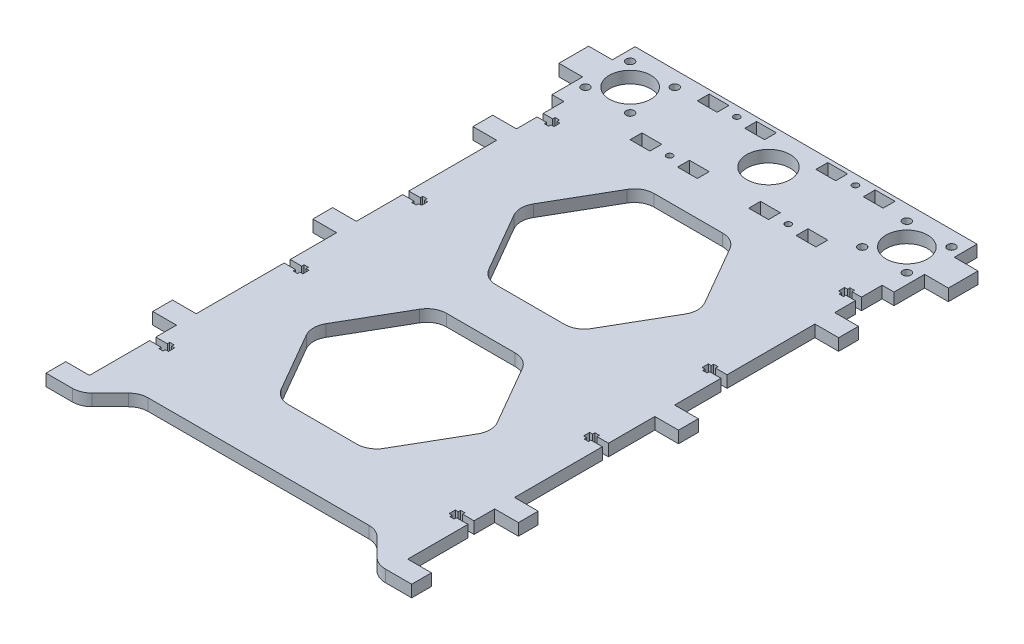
SolidWorks part; units mm, degrees
ref_plane "Спереди" through (0, 0, 0) normal (0, 0, 1) x (1, 0, 0)
ref_plane "Сверху" through (0, 0, 0) normal (0, 1, 0) x (1, 0, 0)
ref_plane "Справа" through (0, 0, 0) normal (1, 0, 0) x (0, 0, -1)
sketch "Эскиз1" plane through (0, 0, 0) normal (0, 1, 0) x (1, 0, 0)
  line L0 (0, 174.0474) -> (0, 0) construction
  line L1 (0, 0) -> (123.4483, 0) construction
  line L2 (13, 150) -> (23, 150)
  line L3 (86.5, 152) -> (86.5, 140.5)
  line L4 (92.5, -140) -> (0, -140)
  line L5 (0, 133) -> (112.9832, 133) construction
  line L6 (86.5, 140.5) -> (98.5, 140.5)
  line L7 (98.5, 140.5) -> (98.5, 125.5)
  line L8 (98.5, 125.5) -> (86.5, 125.5)
  line L9 (86.5, 125.5) -> (86.5, 110)
  line L10 (23, 150) -> (23, 144)
  line L11 (23, 144) -> (13, 144)
  line L12 (13, 144) -> (13, 150)
  line L13 (37, 150) -> (47, 150)
  line L14 (30, 147) -> (30, 154.7506) construction
  line L15 (18, 144) -> (18, 152.7899) construction
  line L16 (47, 144) -> (47, 150)
  line L17 (37, 144) -> (47, 144)
  line L18 (37, 150) -> (37, 144)
  line L19 (13, 147) -> (47, 147) construction
  line L20 (86.5, 110) -> (80.5, 110)
  line L21 (80.5, 110) -> (80.5, 99.55)
  line L22 (92.5, -140) -> (92.5, -130)
  line L23 (92.5, -130) -> (80.5, -130)
  line L24 (80.5, -86) -> (80.5, -96.45)
  line L25 (0, 152) -> (86.5, 152)
  line L28 (80.5, -5) -> (92.5, -5)
  line L29 (92.5, -5) -> (92.5, 5)
  line L30 (92.5, 5) -> (80.5, 5)
  line L31 (80.5, -5) -> (80.5, -28.45)
  line L32 (0, 152) -> (0, 144)
  line L33 (0, 122) -> (0, -140)
  line L34 (80.5, 98) -> (67.761, 98) construction
  line L35 (58.7, 121.7) -> (81.3, 121.7) construction
  line L36 (58.7, 121.7) -> (58.7, 144.3) construction
  line L37 (58.7, 144.3) -> (81.3, 144.3) construction
  line L38 (81.3, 121.7) -> (81.3, 144.3) construction
  line L39 (58.7, 121.7) -> (81.3, 144.3) construction
  line L40 (58.7, 144.3) -> (81.3, 121.7) construction
  line L41 (80.5, 99.55) -> (75.7, 99.55)
  line L42 (75.7, 99.55) -> (75.7, 100.75)
  line L43 (75.7, 100.75) -> (73.5, 100.75)
  line L44 (73.5, 100.75) -> (73.5, 99.55)
  line L45 (73.5, 99.55) -> (72, 99.55)
  line L46 (72, 99.55) -> (72, 96.45)
  line L47 (73.5, 96.45) -> (72, 96.45)
  line L48 (73.5, 95.25) -> (73.5, 96.45)
  line L49 (75.7, 95.25) -> (73.5, 95.25)
  line L50 (75.7, 96.45) -> (75.7, 95.25)
  line L51 (80.5, 96.45) -> (75.7, 96.45)
  line L52 (80.5, 96.45) -> (80.5, 86)
  line L53 (87.2498, 30) -> (69.0562, 30) construction
  line L54 (80.5, 31.55) -> (74.7, 31.55)
  line L55 (74.7, 31.55) -> (74.7, 32.75)
  line L56 (74.7, 32.75) -> (72.5, 32.75)
  line L57 (72.5, 32.75) -> (72.5, 31.55)
  line L58 (72.5, 31.55) -> (71, 31.55)
  line L59 (71, 31.55) -> (71, 28.45)
  line L60 (72.5, 28.45) -> (71, 28.45)
  line L61 (72.5, 27.25) -> (72.5, 28.45)
  line L62 (74.7, 27.25) -> (72.5, 27.25)
  line L63 (74.7, 28.45) -> (74.7, 27.25)
  line L64 (80.5, 28.45) -> (74.7, 28.45)
  line L65 (80.5, 28.45) -> (80.5, 5)
  line L67 (80.5, -96.45) -> (74.7, -96.45)
  line L68 (74.7, -96.45) -> (74.7, -95.25)
  line L69 (74.7, -95.25) -> (72.5, -95.25)
  line L70 (72.5, -95.25) -> (72.5, -96.45)
  line L71 (72.5, -96.45) -> (71, -96.45)
  line L72 (71, -99.55) -> (71, -96.45)
  line L73 (72.5, -99.55) -> (71, -99.55)
  line L74 (72.5, -100.75) -> (72.5, -99.55)
  line L75 (74.7, -100.75) -> (72.5, -100.75)
  line L76 (74.7, -99.55) -> (74.7, -100.75)
  line L77 (80.5, -99.55) -> (74.7, -99.55)
  line L78 (87.2498, -30) -> (69.0562, -30) construction
  line L79 (80.5, -28.45) -> (74.7, -28.45)
  line L80 (74.7, -28.45) -> (74.7, -27.25)
  line L81 (74.7, -27.25) -> (72.5, -27.25)
  line L82 (72.5, -27.25) -> (72.5, -28.45)
  line L83 (72.5, -28.45) -> (71, -28.45)
  line L84 (71, -31.55) -> (71, -28.45)
  line L85 (72.5, -31.55) -> (71, -31.55)
  line L86 (72.5, -32.75) -> (72.5, -31.55)
  line L87 (74.7, -32.75) -> (72.5, -32.75)
  line L88 (74.7, -31.55) -> (74.7, -32.75)
  line L89 (80.5, -31.55) -> (74.7, -31.55)
  line L90 (80.5, -99.55) -> (80.5, -130)
  line L91 (80.5, -31.55) -> (80.5, -76)
  line L92 (13, 110) -> (23, 110)
  line L93 (47, 110) -> (37, 110)
  line L94 (47, 110) -> (47, 116)
  line L95 (47, 116) -> (37, 116)
  line L96 (37, 110) -> (37, 116)
  line L97 (23, 110) -> (23, 116)
  line L98 (13, 116) -> (23, 116)
  line L99 (13, 110) -> (13, 116)
  line L100 (23, 113) -> (37, 113) construction
  line L101 (80.5, 86) -> (92.5, 86)
  line L102 (92.5, 86) -> (92.5, 76)
  line L103 (92.5, 76) -> (80.5, 76)
  line L104 (80.5, 76) -> (80.5, 31.55)
  line L105 (92.5, -76) -> (80.5, -76)
  line L106 (92.5, -86) -> (92.5, -76)
  line L107 (80.5, -86) -> (92.5, -86)
  arc A0 (0, 122) -> (0, 144) centre (0, 133) ccw
  circle A1 centre (70, 133) radius 10.5
  circle A2 centre (30, 147) radius 1.55
  circle A3 centre (58.7, 144.3) radius 2.05
  circle A4 centre (81.3, 144.3) radius 2.05
  circle A5 centre (58.7, 121.7) radius 2.05
  circle A6 centre (81.3, 121.7) radius 2.05
  circle A7 centre (30, 113) radius 1.55
  point P43 (92.5, 0)
  dimension "D2" = 21
  dimension "D3" = 22
  dimension "D4" = 10
  dimension "D9" = 3.1
  dimension "D10" = 60
  dimension "D11" = 6
  dimension "D12" = 12
  dimension "D14" = 11
  dimension "D15" = 19
  dimension "D16" = 240
  dimension "D19" = 4.1
  dimension "D1" = 140
  dimension "D5" = 15
  dimension "D6" = 12
  dimension "D7" = 6
  dimension "D8" = 173
  dimension "D13" = 10
  dimension "D17" = 23
  dimension "D18" = 22.6
  dimension "D20" = 3.1
  dimension "D21" = 2.2
  dimension "D22" = 5.5
  dimension "D23" = 1.5
  dimension "D24" = 8.5
  dimension "D25" = 12
  dimension "D26" = 7.5
  dimension "D27" = 12
  dimension "D28" = 12
  dimension "D29" = 133
  dimension "D30" = 30
  dimension "D31" = 10
  dimension "D32" = 9.5
extrude "Бобышка-Вытянуть2" add sketch "Эскиз1" along normal blind 6
mirror "Зеркальное отражение1" about plane through (0, 6, -122) normal (1, 0, 0)
sketch "Эскиз2" plane through (0, 6, 0) normal (0, 1, 0) x (1, 0, 0)
  line L0 (0, 0) -> (0, 164.4816) construction
  line L1 (0, 0) -> (148.1195, 0) construction
  line L3 (23.094, 12.5) -> (46.188, 52.5)
  line L4 (46.188, 52.5) -> (23.094, 92.5)
  line L5 (23.094, 92.5) -> (-23.094, 92.5)
  line L6 (-23.094, 92.5) -> (-46.188, 52.5)
  line L7 (-46.188, 52.5) -> (-23.094, 12.5)
  line L8 (-23.094, 12.5) -> (23.094, 12.5)
  line L9 (23.094, -12.5) -> (46.188, -52.5)
  line L10 (-23.094, -12.5) -> (23.094, -12.5)
  line L11 (-46.188, -52.5) -> (-23.094, -12.5)
  line L12 (-23.094, -92.5) -> (-46.188, -52.5)
  line L13 (23.094, -92.5) -> (-23.094, -92.5)
  line L14 (46.188, -52.5) -> (23.094, -92.5)
  circle A0 centre (0, 52.5) radius 40 construction
  circle A1 centre (0, -52.5) radius 40 construction
  dimension "D1" = 80
  dimension "D2" = 105
extrude "Вырез-Вытянуть4" cut sketch "Эскиз2" against normal through all
sketch "Эскиз3" plane through (0, 6, 0) normal (0, 1, 0) x (1, 0, 0)
  line L0 (0, 0) -> (0, -157.4314) construction
  line L1 (-75, -140) -> (75, -140)
  line L2 (-92.5, -140) -> (92.5, -140) construction
  line L3 (75, -140) -> (60, -125)
  line L4 (60, -125) -> (-60, -125)
  line L5 (-75, -140) -> (-60, -125)
  point P10 (0, -125)
  point P11 (0, -140)
  dimension "D1" = 15
  dimension "D2" = 150
  dimension "D3" = 120
extrude "Вырез-Вытянуть5" cut sketch "Эскиз3" against normal through all
fillet "Скругление1" radius 10 16 edges at (75, 3, 140) (60, 3, 125) (-75, 3, 140) (-60, 3, 125) (-23.094, 3, 92.5) (23.094, 3, 92.5) (46.188, 3, 52.5) (-46.188, 3, 52.5) (-23.094, 3, 12.5) (23.094, 3, 12.5) (-23.094, 3, -12.5) (23.094, 3, -12.5) (46.188, 3, -52.5) (-46.188, 3, -52.5) (23.094, 3, -92.5) (-23.094, 3, -92.5)
